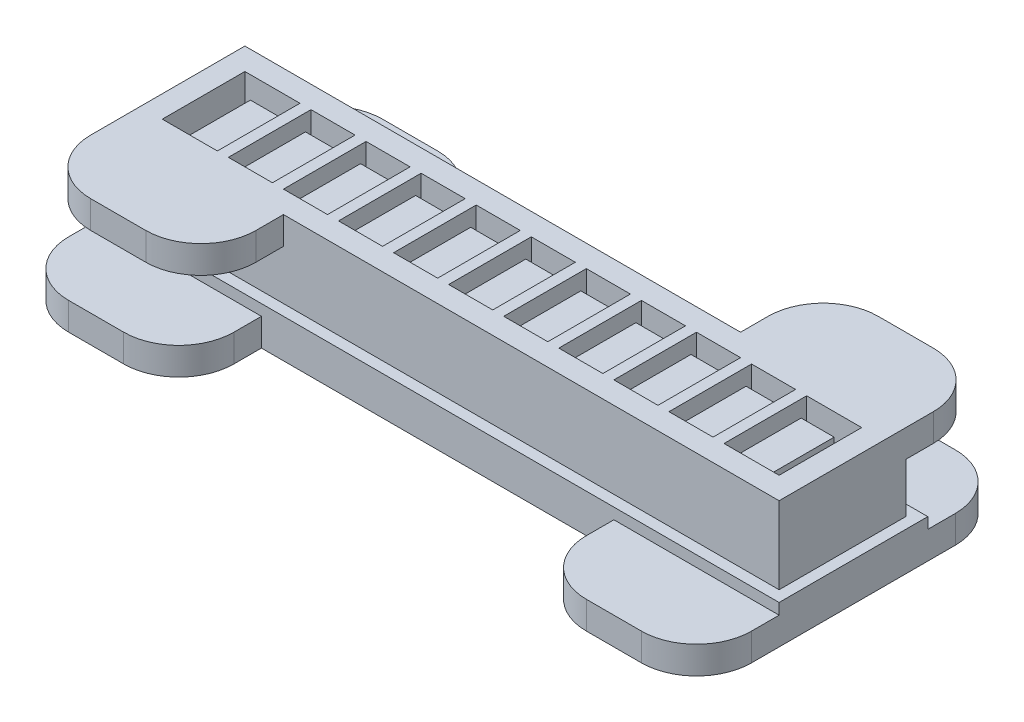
SolidWorks part; units mm, degrees
other "mold top"
other "mold bottom"
ref_plane "Front Plane" through (0, 0, 0) normal (0, 0, 1) x (1, 0, 0)
ref_plane "Top Plane" through (0, 0, 0) normal (0, 1, 0) x (1, 0, 0)
ref_plane "Right Plane" through (0, 0, 0) normal (1, 0, 0) x (0, 0, -1)
sketch "Sketch1" plane through (0, 0, 0) normal (0, 0, 1) x (1, 0, 0)
  line L1 (0, 0) -> (8, 0)
  line L2 (0, 0) -> (0, 15)
  line L3 (0, 15) -> (8, 15)
  line L4 (8, 0) -> (8, 15)
  dimension "D1" = 8
  dimension "D2" = 15
extrude "first chamber block" add sketch "Sketch1" along normal blind 15
sketch "Sketch2" plane through (0, 0, 0) normal (0, -1, 0) x (1, 0, 0)
  line L0 (8, 15) -> (8, 0) construction
  line L1 (1, 13) -> (7, 13)
  line L2 (1, 13) -> (1, 2)
  line L3 (1, 2) -> (7, 2)
  line L4 (7, 13) -> (7, 2)
  line L5 (0, 15) -> (0, 0) construction
  line L6 (0, 15) -> (8, 15) construction
  line L7 (0, 0) -> (8, 0) construction
  dimension "D1" = 1
  dimension "D2" = 1
  dimension "D3" = 2
  dimension "D4" = 2
extrude "first chamber cavity" cut sketch "Sketch2" against normal blind 13
sketch "Sketch3" plane through (8, 0, 0) normal (1, 0, 0) x (0, 0, -1)
  line L0 (-15, 0) -> (-15, 15) construction
  line L1 (0, 0) -> (-15, 0)
  line L2 (0, 0) -> (0, 3)
  line L3 (0, 3) -> (-15, 3)
  line L4 (-15, 0) -> (-15, 3)
  dimension "D1" = 3
extrude "chamber spacer" add sketch "Sketch3" along normal blind 2
pattern_linear "pattern chambers" count 11 spacing 10 along (1, 0, 0) of "chamber spacer", "first chamber cavity", "first chamber block"
combine bodies "combine into 1 solid body" operation type add bodies to combine 123 122 121 120 119 118 117 116 115 114 103
sketch "Sketch4" plane through (108, 0, 0) normal (1, 0, 0) x (0, 0, -1)
  line L1 (0, 15) -> (-15, 15)
  line L2 (0, 15) -> (0, 3)
  line L3 (0, 3) -> (-15, 3)
  line L4 (-15, 15) -> (-15, 3)
extrude "thicken end 1" add sketch "Sketch4" along normal up to surface (2 mm away)
sketch "Sketch5" plane through (0, 0, 0) normal (-1, 0, 0) x (0, 0, 1)
  line L1 (15, 15) -> (0, 15)
  line L2 (15, 15) -> (15, 0)
  line L3 (15, 0) -> (0, 0)
  line L4 (0, 15) -> (0, 0)
extrude "thicken end 2" add sketch "Sketch5" along normal blind 2
ref_point "center of bottom face"
sketch "Sketch6" plane through (0, 0, 0) normal (0, -1, 0) x (1, 0, 0)
  line L0 (7, 2) -> (7, 13) construction
  line L1 (101, 6.5) -> (7, 6.5)
  line L2 (101, 6.5) -> (101, 8.5)
  line L3 (101, 8.5) -> (7, 8.5)
  line L4 (7, 6.5) -> (7, 8.5)
  line L5 (101, 6.5) -> (7, 8.5) construction
  line L6 (101, 8.5) -> (7, 6.5) construction
  point P0 (54, 7.5)
  dimension "D1" = 2
extrude "central air channel" cut sketch "Sketch6" against normal blind 2
sketch "Sketch7" plane through (0, 0, 0) normal (0, -1, 0) x (1, 0, 0)
  line L0 (0, 14) -> (108, 14)
  line L1 (1, 13) -> (107, 13)
  line L2 (1, 13) -> (1, 2)
  line L3 (1, 2) -> (107, 2)
  line L4 (107, 13) -> (107, 2)
  line L5 (108, 14) -> (108, 1)
  line L6 (0, 1) -> (108, 1)
  line L7 (0, 14) -> (0, 1)
  dimension "D1" = 1
extrude "bonding ridge" add sketch "Sketch7" along normal blind 2
sketch "Sketch9" plane through (0, 0, 0) normal (0, -1, 0) x (1, 0, 0)
  line L0 (11, 8.5) -> (11, 13) construction
  line L1 (11, 13) -> (7, 13) construction
  line L2 (7, 13) -> (7, 8.5) construction
  line L3 (7, 8.5) -> (11, 8.5) construction
  line L4 (7, 6.5) -> (7, 2) construction
  line L5 (7, 2) -> (11, 2) construction
  line L6 (11, 2) -> (11, 6.5) construction
  line L7 (11, 6.5) -> (7, 6.5) construction
  line L8 (11, 8.5) -> (11, 13) construction
  line L9 (11, 13) -> (7, 13) construction
  line L10 (7, 13) -> (7, 8.5) construction
  line L11 (7, 8.5) -> (11, 8.5) construction
  line L12 (7, 6.5) -> (7, 2) construction
  line L13 (7, 2) -> (11, 2) construction
  line L14 (11, 2) -> (11, 6.5) construction
  line L15 (11, 6.5) -> (7, 6.5) construction
  line L16 (10, 9.5) -> (10, 12)
  line L17 (10, 12) -> (8, 12)
  line L18 (8, 12) -> (8, 9.5)
  line L19 (8, 9.5) -> (10, 9.5)
  line L20 (8, 5.5) -> (8, 3)
  line L21 (8, 3) -> (10, 3)
  line L22 (10, 3) -> (10, 5.5)
  line L23 (10, 5.5) -> (8, 5.5)
  dimension "D1" = 1
extrude "bonding bumps" add sketch "Sketch9" along normal blind 2
pattern_linear "pattern bonding bumps" count 10 spacing 10 along (1, 0, 0) of "bonding bumps"
sketch "Sketch10" plane through (0, 15, 0) normal (0, 1, 0) x (1, 0, 0)
  line L0 (-6, 4) -> (114, 4)
  line L1 (-2, 0) -> (110, 0) construction
  line L2 (-2, 0) -> (-2, -15) construction
  line L3 (-2, -15) -> (110, -15) construction
  line L4 (110, 0) -> (110, -15) construction
  line L5 (114, 4) -> (114, -19)
  line L6 (-6, -19) -> (114, -19)
  line L7 (-6, 4) -> (-6, -19)
  dimension "D1" = 4
extrude "encasing block" add sketch "Sketch10" against normal offset from surface (21 mm away) 4 separate body
combine bodies "subtract actuator" operation type subtract main body 133 bodies to subtract 132
split "split mold" bodies to split 134 resulting bodies 140 141
sketch "Sketch11" plane through (0, 0, 19) normal (0, 0, 1) x (1, 0, 0)
  line L1 (-6, 15) -> (24, 15)
  line L2 (-6, 15) -> (-6, 10)
  line L3 (-6, 10) -> (24, 10)
  line L4 (24, 15) -> (24, 10)
  dimension "D1" = 30
  dimension "D2" = 5
extrude "grip tab 1" add sketch "Sketch11" along normal blind 15
sketch "Sketch12" plane through (0, 0, -4) normal (0, 0, -1) x (-1, 0, 0)
  line L1 (-114, 15) -> (-84, 15)
  line L2 (-114, 15) -> (-114, 10)
  line L3 (-114, 10) -> (-84, 10)
  line L4 (-84, 15) -> (-84, 10)
  dimension "D1" = 30
  dimension "D2" = 5
extrude "grip tab 2" add sketch "Sketch12" along normal blind 15
fillet "fillet grip tabs" radius 10 4 edges at (114, 12.5, -19) (84, 12.5, -19) (24, 12.5, 34) (-6, 12.5, 34)
sketch "Sketch13" plane through (0, -6, 0) normal (0, -1, 0) x (1, 0, 0)
  line L0 (-8, 21) -> (-8, -6)
  line L1 (-6, 19) -> (114, 19)
  line L2 (-6, 19) -> (-6, -4)
  line L3 (-6, -4) -> (114, -4)
  line L4 (114, 19) -> (114, -4)
  line L5 (-8, -6) -> (116, -6)
  line L6 (116, 21) -> (116, -6)
  line L7 (-8, 21) -> (116, 21)
  dimension "D1" = 2
extrude "base mold lip" add sketch "Sketch13" against normal offset from surface (7 mm away) 1
sketch "Sketch14" plane through (0, 0, 21) normal (0, 0, 1) x (1, 0, 0)
  line L1 (-8, -6) -> (22, -6)
  line L2 (-8, -6) -> (-8, -1)
  line L3 (-8, -1) -> (22, -1)
  line L4 (22, -6) -> (22, -1)
  line L5 (116, -6) -> (86, -6)
  line L6 (116, -6) -> (116, -1)
  line L7 (116, -1) -> (86, -1)
  line L8 (86, -6) -> (86, -1)
  dimension "D1" = 30
  dimension "D2" = 5
  dimension "D3" = 30
  dimension "D4" = 5
extrude "base grip tabs 1 and 2" add sketch "Sketch14" along normal blind 15
sketch "Sketch16" plane through (0, 0, -6) normal (0, 0, -1) x (-1, 0, 0)
  line L1 (-116, -6) -> (-86, -6)
  line L2 (-116, -6) -> (-116, -1)
  line L3 (-116, -1) -> (-86, -1)
  line L4 (-86, -6) -> (-86, -1)
  line L5 (8, -6) -> (-22, -6)
  line L6 (8, -6) -> (8, -1)
  line L7 (8, -1) -> (-22, -1)
  line L8 (-22, -6) -> (-22, -1)
  dimension "D1" = 30
  dimension "D2" = 5
  dimension "D3" = 30
extrude "base grip tabs 3 and 4" add sketch "Sketch16" along normal blind 15
fillet "fillet base grip tabs" radius 10 8 edges at (116, -3.5, -21) (86, -3.5, -21) (22, -3.5, -21) (-8, -3.5, -21) (116, -3.5, 36) (86, -3.5, 36) (22, -3.5, 36) (-8, -3.5, 36)
